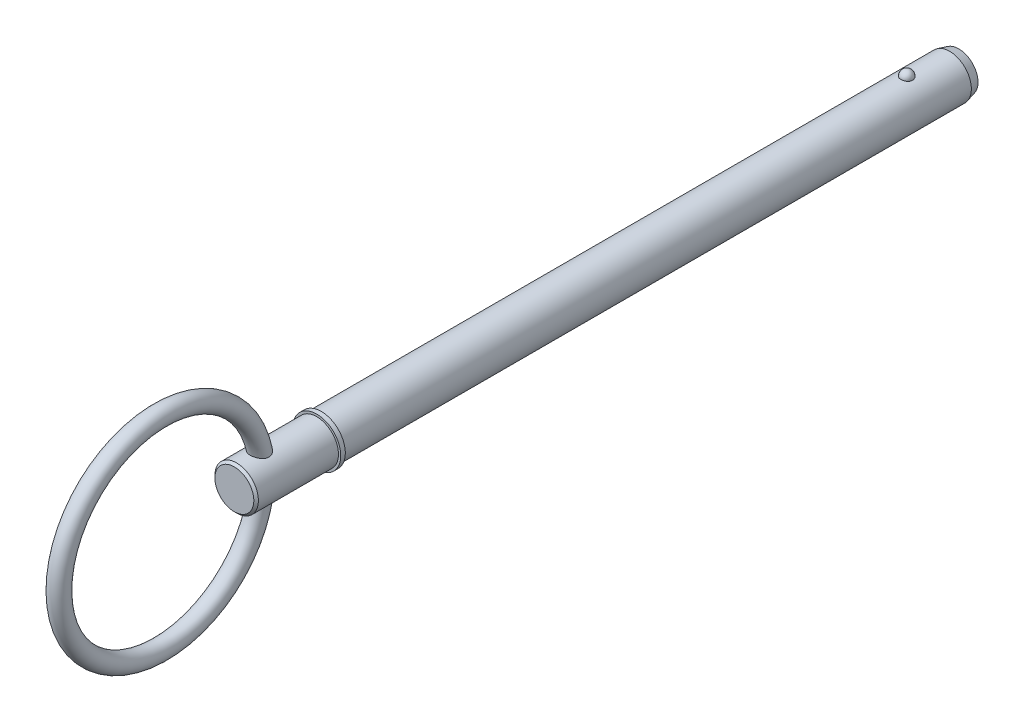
SolidWorks part; units mm, degrees
ref_plane "Front Plane" through (0, 0, 0) normal (0, 0, 1) x (1, 0, 0)
ref_plane "Top Plane" through (0, 0, 0) normal (0, 1, 0) x (1, 0, 0)
ref_plane "Right Plane" through (0, 0, 0) normal (1, 0, 0) x (0, 0, -1)
sketch "Sketch2" plane through (0, 0, 0) normal (0, 0, 1) x (1, 0, 0)
  circle A0 centre (0, 0) radius 4.765
  point P3 (0, 4.765)
  dimension "D1" = 9.53
extrude "Boss-Extrude1" add sketch "Sketch2" along normal blind 127
sketch "Sketch3" plane through (0, 0, 0) normal (0, 0, -1) x (-1, 0, 0)
  circle A0 centre (0, 0) radius 4.765
  dimension "D1" = 9.53
extrude "Boss-Extrude2" add sketch "Sketch3" along normal blind 12.7
chamfer "Chamfer1" distance 2 angle 15 1 edges at (-4.765, 0, -12.7)
sketch "Sketch18" plane through (0, 0, 0) normal (1, 0, 0) x (0, 0, -1)
  line L0 (10.7, 4.765) -> (-127, 4.765) construction
  line L1 (1.29, 6.055) -> (1.29, 3.475)
  line L2 (-127, -4.765) -> (10.7, -4.765) construction
  arc A0 (1.29, 6.055) -> (1.29, 3.475) centre (1.29, 4.765) ccw
  point P4 (0, 4.765)
  dimension "D1" = 10.82
revolve "Revolve1" add sketch "Sketch18" angle 360 about L1
sketch "Sketch19" plane through (0, 0, 0) normal (1, 0, 0) x (0, 0, -1)
  line L0 (-33.7288, 0) -> (-46.4542, 0) construction
sketch "Sketch20" plane through (0, 0, 0) normal (1, 0, 0) x (0, 0, -1)
  line L0 (-127, 0) -> (-127, 5.265)
  line L1 (-127, 4.765) -> (-127, -4.765) construction
  line L2 (-127, 5.265) -> (-128, 5.265)
  line L3 (-128, 5.265) -> (-128, 0)
  line L4 (-33.7288, 0) -> (-46.4542, 0) construction
  line L5 (-128, 0) -> (-127, 0)
  dimension "D1" = 5.265
  dimension "D2" = 1
revolve "Revolve2" add sketch "Sketch20" angle 360 about L0
sketch "Sketch21" plane through (0, 0, 127) normal (0, 0, -1) x (-1, 0, 0)
  circle A0 centre (0, 0) radius 4.765
  dimension "D1" = 9.53
extrude "Boss-Extrude3" add sketch "Sketch21" against normal blind 19.05
chamfer "Chamfer2" distance 0.5 angle 45 1 edges at (-4.765, 0, 146.05)
sketch "Sketch23" plane through (0, 0, 0) normal (1, 0, 0) x (0, 0, -1)
  line L0 (-146.05, 4.265) -> (-146.05, -4.265) construction
  circle A0 centre (-162.275, 0) radius 22.225
  point P2 (-140.05, 0)
  dimension "D1" = 44.45
  dimension "D2" = 6
sketch "Sketch24" plane through (0, 0, 0) normal (0, 1, 0) x (1, 0, 0)
  circle A0 centre (0, -140.05) radius 2
  dimension "D1" = 4
sweep "Sweep1" add profiles "Sketch24" path "Sketch23"
